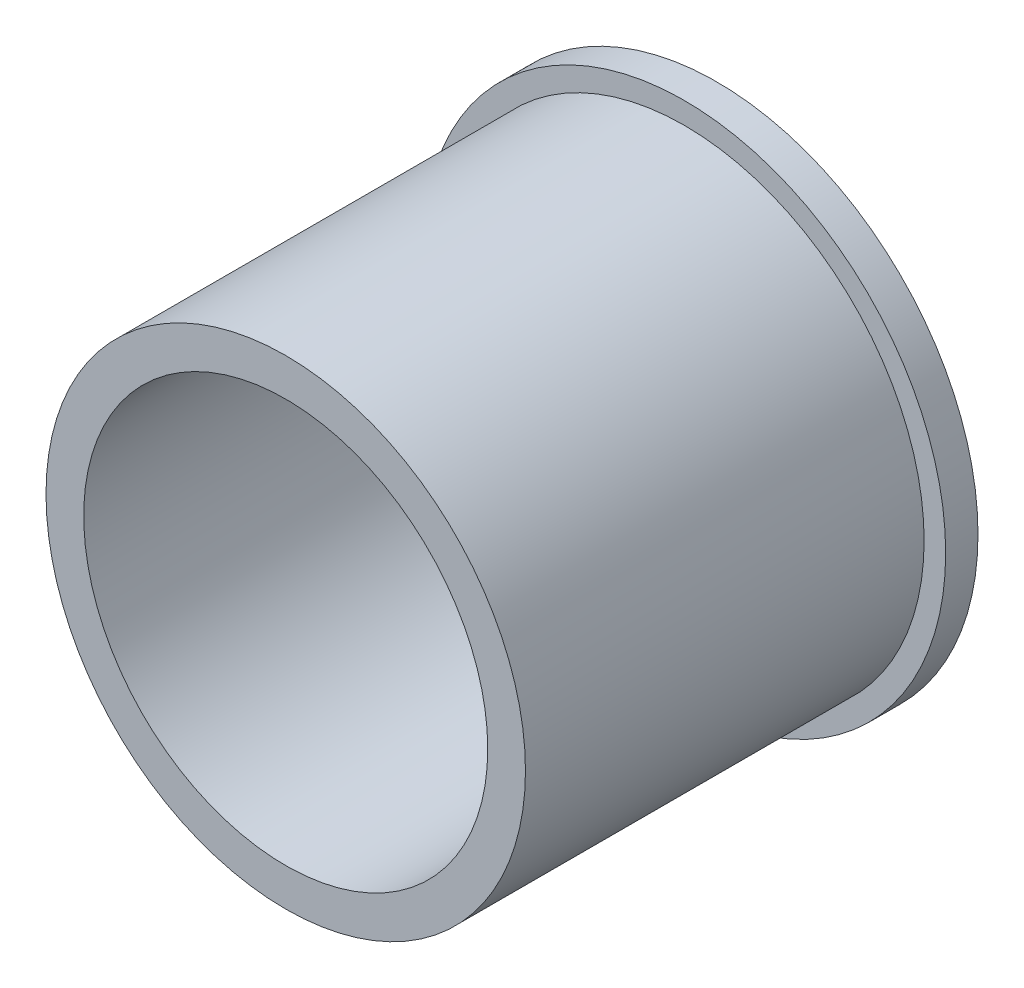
SolidWorks part; units mm, degrees
ref_plane "Front Plane" through (0, 0, 0) normal (0, 0, 1) x (1, 0, 0)
ref_plane "Top Plane" through (0, 0, 0) normal (0, 1, 0) x (1, 0, 0)
ref_plane "Right Plane" through (0, 0, 0) normal (1, 0, 0) x (0, 0, -1)
sketch "Sketch1" plane through (0, 0, 0) normal (0, 1, 0) x (1, 0, 0)
  line L0 (0, -5.08) -> (0, 5.08) construction
  line L1 (-4.7625, -5.08) -> (-5.6515, -5.08)
  line L2 (-5.6515, -5.08) -> (-5.6515, 4.318)
  line L3 (-5.6515, 4.318) -> (-6.1595, 4.318)
  line L4 (-6.1595, 4.318) -> (-6.1595, 5.08)
  line L5 (-6.1595, 5.08) -> (-4.7625, 5.08)
  line L6 (-4.7625, 5.08) -> (-4.7625, -5.08)
  dimension "D1" = 9.525
  dimension "D2" = 11.303
  dimension "D3" = 10.16
  dimension "D4" = 0.762
  dimension "D5" = 12.319
revolve "Revolve1" add sketch "Sketch1" angle 360 about L0
